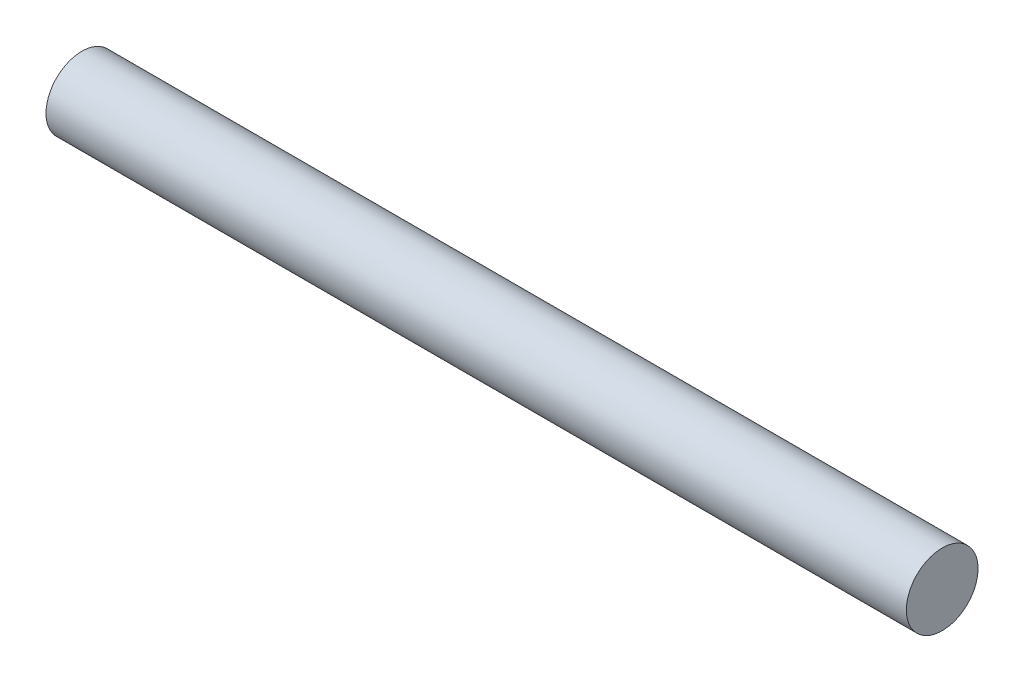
SolidWorks part; units mm, degrees
ref_plane "Front Plane" through (0, 0, 0) normal (0, 0, 1) x (1, 0, 0)
ref_plane "Top Plane" through (0, 0, 0) normal (0, 1, 0) x (1, 0, 0)
ref_plane "Right Plane" through (0, 0, 0) normal (1, 0, 0) x (0, 0, -1)
sketch "Sketch1" plane through (0, 0, 0) normal (1, 0, 0) x (0, 0, -1)
  circle A0 centre (0, 0) radius 3.175
  dimension "D1" = 6.35
extrude "Boss-Extrude1" add sketch "Sketch1" along normal mid plane 76.2
